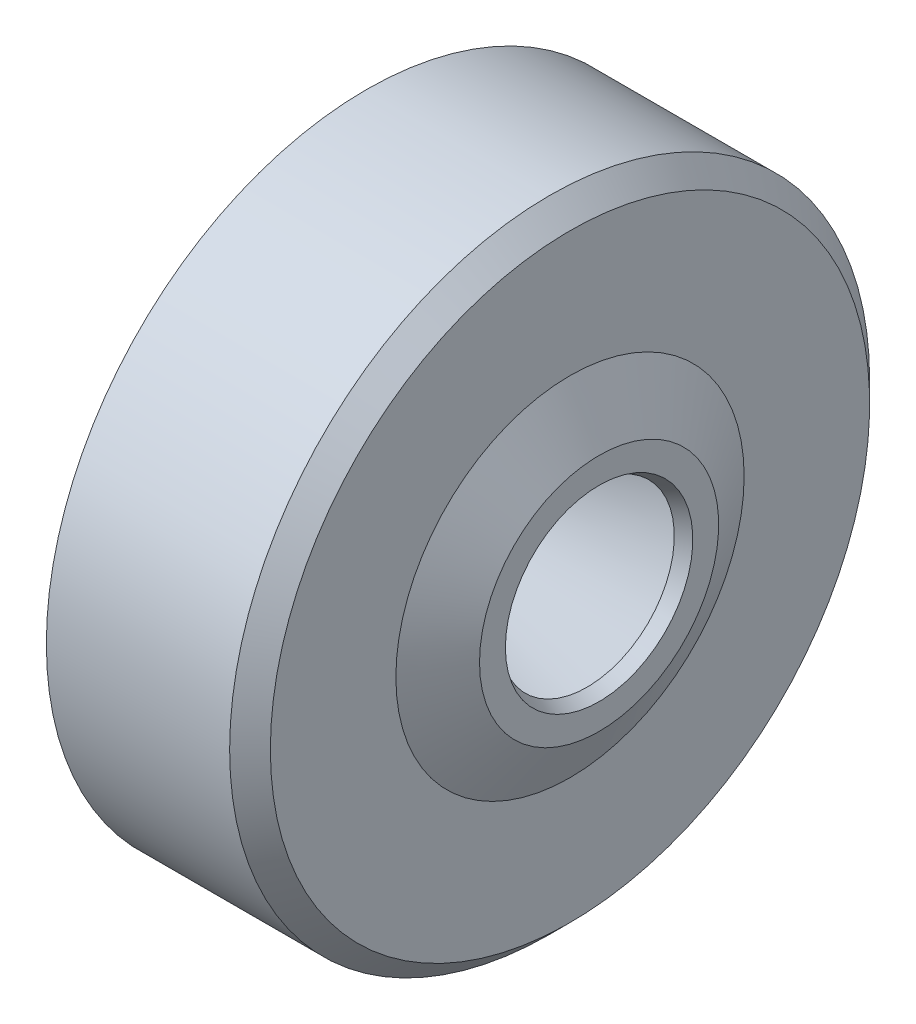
SolidWorks part; units mm, degrees
revolve "Base-Rev" add sketch "Ske" angle 360 about L0
sketch "Ske" plane through (0, 0, 0) normal (0, 0, 1) x (1, 0, 0)
  line L0 (-7, 0) -> (7, 0) construction
  line L1 (1.4, 5.9857) -> (0.7, 5.9857)
  line L2 (0.7, 5.9857) -> (0.7, 4.1194)
  line L3 (0, 11) -> (6.3, 11)
  line L4 (7, 5.9857) -> (7, 10.3)
  line L5 (0, 9.2222) -> (3.9667, 9.2222)
  line L6 (4.6667, 8.5222) -> (4.6667, 5.9857)
  line L7 (3.9667, 5.2857) -> (2.1, 5.2857)
  line L8 (0, 9.2222) -> (0, 11)
  line L9 (0.7, 4.1194) -> (2.1, 3)
  line L10 (2.1, 3) -> (7, 5.9857)
  line L12 (6.3, 11) -> (7, 10.3)
  arc A0 (4.6667, 8.5222) -> (3.9667, 9.2222) centre (3.9667, 8.5222) ccw
  arc A1 (4.6667, 5.9857) -> (3.9667, 5.2857) centre (3.9667, 5.9857) cw
  arc A2 (2.1, 5.2857) -> (1.4, 5.9857) centre (2.1, 5.9857) ccw
  point P1 (7, 11)
ref_plane "Спереди" through (0, 0, 0) normal (0, 0, 1) x (1, 0, 0)
ref_plane "Сверху" through (0, 0, 0) normal (0, 1, 0) x (1, 0, 0)
ref_plane "Справа" through (0, 0, 0) normal (1, 0, 0) x (0, 0, -1)
sketch "Ske2" plane through (0, 0, 0) normal (0, 0, 1) x (1, 0, 0)
  line L0 (7, 5.9857) -> (8, 4.1103)
  line L2 (5.9926, 5.9857) -> (7.5847, 3)
  line L3 (7, 5.9857) -> (5.9926, 5.9857)
  line L4 (7.5847, 3) -> (8, 3.2214)
  line L6 (-1.3061, 0) -> (7, 0) construction
  line L9 (8, 4.1103) -> (8, 3.2214)
  line L10 (0.7, 5.9857) -> (0.7, 4.1194) construction
  line L11 (0, 11) -> (0, -11) construction
revolve "Rev1" add sketch "Ske2" angle 360 about L6
equation "\"D4@Ske\" = \"D3@Ske\"/3"
equation "\"D7@Ske\" = \"D3@Ske\"/10"
equation "\"D8@Ske\" = \"D3@Ske\"/10"
equation "\"D10@Ske\" = \"D7@Ske\"*2"
equation "\"D6@Ske\"=(\"D2@Ske\"-\"D11@Ske\")/7"
equation "\"D1@Ske\" = \"D7@Ske\""
equation "\"D1@Ske2\"=\"D5@Ske\"*.5"
equation "\"D3@Ske2\"=\"D1@Ske2\""
